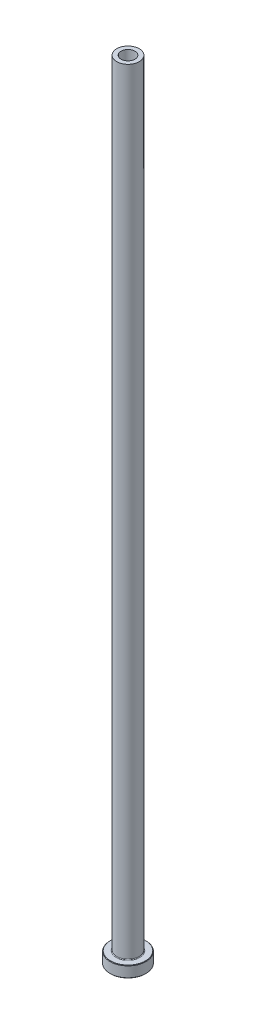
SolidWorks part; units mm, degrees
ref_plane "Front Plane" through (0, 0, 0) normal (0, 0, 1) x (1, 0, 0)
ref_plane "Top Plane" through (0, 0, 0) normal (0, 1, 0) x (1, 0, 0)
ref_plane "Right Plane" through (0, 0, 0) normal (1, 0, 0) x (0, 0, -1)
sketch "Sketch1" plane through (0, 0, 0) normal (0, 0, 1) x (1, 0, 0)
  line L0 (-3.1, 350) -> (-5, 350)
  line L1 (-5, 350) -> (-5, 5)
  line L2 (-5, 5) -> (-8, 5)
  line L3 (-8, 5) -> (-8, 0)
  line L4 (8.8, 0) -> (-8.8, 0) construction
  line L5 (-8, 0) -> (-3.35, 0)
  line L6 (-3.1, 305) -> (-3.1, 350)
  line L7 (0, 92.1877) -> (0, -15.5353) construction
  line L8 (0, -8.8) -> (0, 8.8) construction
  line L9 (-3.1, 305) -> (-3.35, 293)
  line L10 (-3.35, 293) -> (-3.35, 0)
  dimension "D1" = 0.25
  dimension "ID" = 6.2
  dimension "OD" = 10
  dimension "L" = 350
  dimension "H" = 16
  dimension "T" = 5
  dimension "N" = 45
  dimension "D2" = 12
revolve "Revolve1" add sketch "Sketch1" angle 360 about L7
fillet "Fillet1" radius 0.3 1 edges at (0, 5, 5)
chamfer "Chamfer1" distance 0.2 angle 45 2 edges at (0, 5, 8) (0, 0, 8)
chamfer "Chamfer3" distance 0.5 angle 45 1 edges at (0, 0, 3.35)
